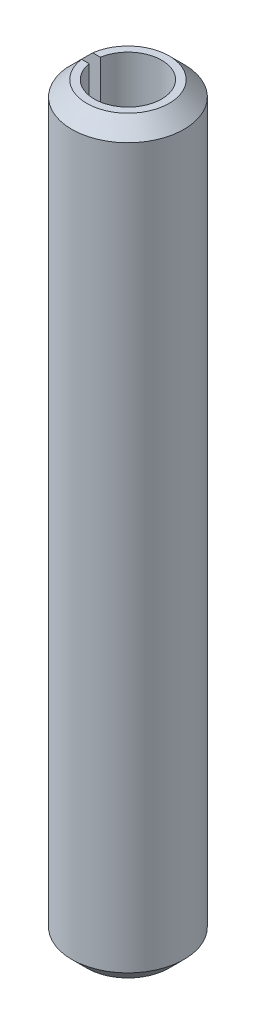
SolidWorks part; units mm, degrees
ref_plane "Face" through (0, 0, 0) normal (0, 0, 1) x (1, 0, 0)
ref_plane "Dessus" through (0, 0, 0) normal (0, 1, 0) x (1, 0, 0)
ref_plane "Droite" through (0, 0, 0) normal (1, 0, 0) x (0, 0, -1)
sketch "Esquisse1" plane through (0, 0, 0) normal (0, 0, 1) x (1, 0, 0)
  line L1 (1.8, 20) -> (1.8, -20)
  line L2 (-3, 0) -> (3, 0) construction
  line L3 (1.8, 20) -> (3, 20)
  line L4 (3, -20) -> (1.8, -20)
  line L5 (0, 20) -> (0, -20) construction
  line L6 (3, 20) -> (3, -20)
  dimension "Epaisseur" = 1.2
  dimension "Longueur" = 40
  dimension "Diamètre nominal" = 6
revolve "Base-Révolution" add sketch "Esquisse1" angle 360 about L5
chamfer "Chanfrein1" distance 0.8 angle 45 2 edges at (0, -20, 3) (0, 20, 3)
sketch "Esquisse2" plane through (0, 0, 0) normal (0, 1, 0) x (-1, 0, 0)
  line L0 (0, 0) -> (3, 0) construction
  line L1 (0, 0.3) -> (0, -0.3)
  line L2 (0, -0.3) -> (3, -0.3)
  line L3 (3, 0.3) -> (3, -0.3)
  line L4 (0, 0.3) -> (3, 0.3)
  circle A0 centre (0, 0) radius 3 construction
  dimension "Frep" = 0.3
extrude "Enlèv. mat.-Extru.1" cut sketch "Esquisse2" against normal through all and the other way through all
equation "\"Ch@Chanfrein1\" = \"Epaisseur@Esquisse1\"/1.5"
equation "\"Frep@Esquisse2\" = (\"Diamètre nominal@Esquisse1\"/2)*0.1"
